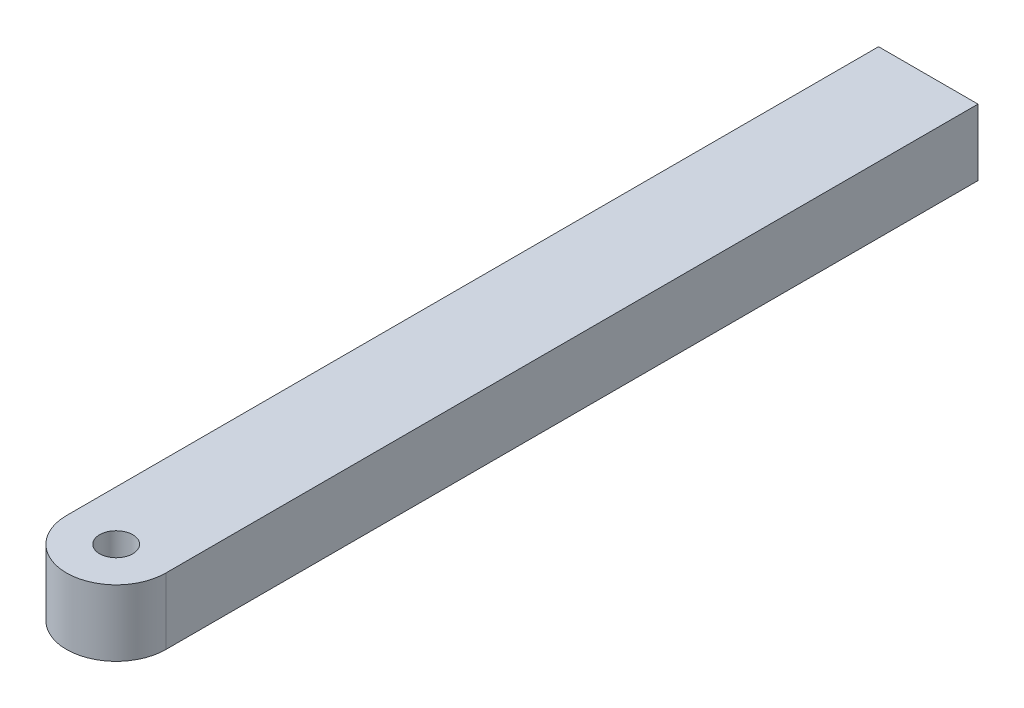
SolidWorks part; units mm, degrees
ref_plane "Front Plane" through (0, 0, 0) normal (0, 0, 1) x (1, 0, 0)
ref_plane "Top Plane" through (0, 0, 0) normal (0, 1, 0) x (1, 0, 0)
ref_plane "Right Plane" through (0, 0, 0) normal (1, 0, 0) x (0, 0, -1)
ref_plane "Plane4" through (0, 0, 0) normal (0, -1, 0) x (1, 0, 0)
sketch "Sketch1" plane through (0, 0, 0) normal (0, -1, 0) x (1, 0, 0)
  line L0 (0, -9.525) -> (0, -165.1)
  line L1 (0, -165.1) -> (19.05, -165.1)
  line L2 (19.05, -165.1) -> (19.05, -9.525)
  arc A0 (19.05, -9.525) -> (0, -9.525) centre (9.525, -9.525) ccw
  circle A1 centre (9.525, -9.525) radius 3.175
extrude "Extrude1" add sketch "Sketch1" against normal blind 12.7
